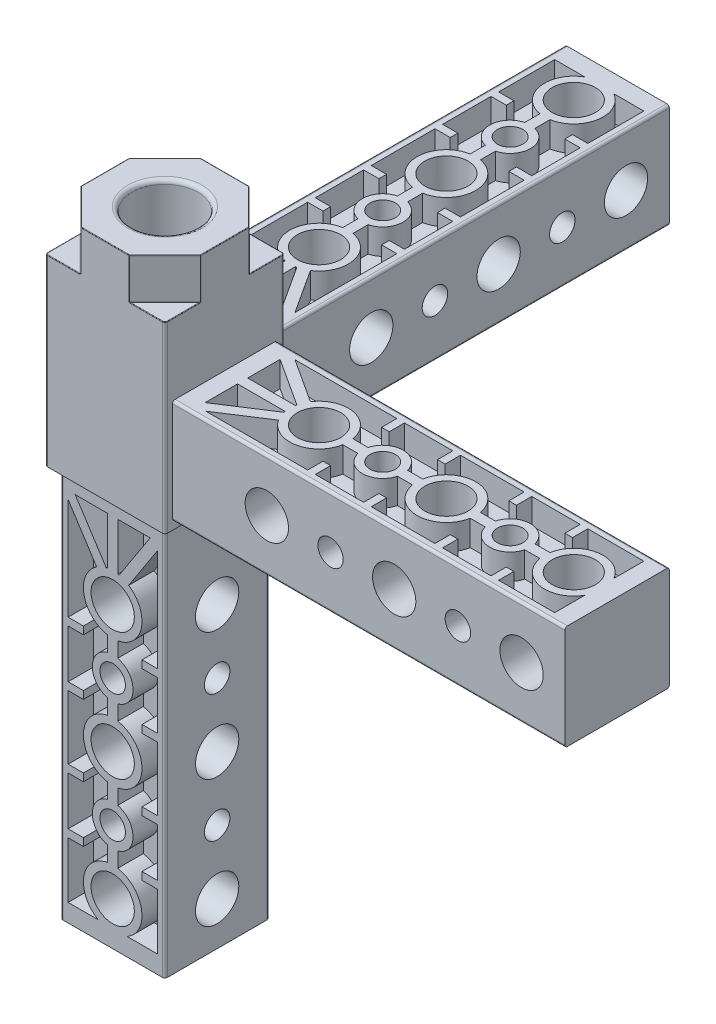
SolidWorks part; units mm, degrees
ref_plane "前视基准面" through (0, 0, 0) normal (0, 0, 1) x (1, 0, 0)
ref_plane "上视基准面" through (0, 0, 0) normal (0, 1, 0) x (1, 0, 0)
ref_plane "右视基准面" through (0, 0, 0) normal (1, 0, 0) x (0, 0, -1)
sketch "草图1" plane through (0, 0, 0) normal (0, 1, 0) x (1, 0, 0)
  line L1 (-11.25, -11.75) -> (11.25, -11.75)
  line L2 (-11.75, -11.25) -> (-11.75, 11.25)
  line L3 (-11.25, 11.75) -> (11.25, 11.75)
  line L4 (11.75, -11.25) -> (11.75, 11.25)
  line L5 (-11.75, -11.75) -> (11.75, 11.75) construction
  line L6 (-11.75, 11.75) -> (11.75, -11.75) construction
  arc A0 (-11.25, -11.75) -> (-11.75, -11.25) centre (-11.25, -11.25) cw
  arc A1 (-11.75, 11.25) -> (-11.25, 11.75) centre (-11.25, 11.25) cw
  arc A2 (11.25, 11.75) -> (11.75, 11.25) centre (11.25, 11.25) cw
  arc A3 (11.25, -11.75) -> (11.75, -11.25) centre (11.25, -11.25) ccw
  point P0 (0, 0)
  dimension "D3" = 0.5
  dimension "D1" = 23.5
  dimension "D2" = 23.5
extrude "拉伸1" add sketch "草图1" along normal blind 44
sketch "草图2" plane through (0, 44, 0) normal (0, 1, 0) x (1, 0, 0)
  line L0 (0, 0) -> (50000, 0) construction
  line L1 (0, 0) -> (0, 50000) construction
  line L2 (-11.25, -11.75) -> (11.25, -11.75) construction
  line L3 (11.75, -11.25) -> (11.75, 11.25) construction
  line L4 (-11.75, 11.25) -> (-11.75, -11.25) construction
  line L5 (11.25, 11.75) -> (-11.25, 11.75) construction
  line L6 (-11.25, -11.75) -> (-4.75, -11.75)
  line L7 (11.75, -11.25) -> (11.75, -4.75)
  line L8 (-11.75, 11.25) -> (-11.75, 4.75)
  line L9 (11.25, 11.75) -> (4.75, 11.75)
  line L10 (-4.75, 11.75) -> (-11.75, 4.75)
  line L11 (4.75, 11.75) -> (11.75, 4.75)
  line L12 (4.75, -11.75) -> (11.75, -4.75)
  line L13 (-4.75, -11.75) -> (-11.75, -4.75)
  line L14 (4.75, -11.75) -> (11.25, -11.75)
  line L15 (-11.75, -4.75) -> (-11.75, -11.25)
  line L16 (11.75, 4.75) -> (11.75, 11.25)
  line L17 (-4.75, 11.75) -> (-11.25, 11.75)
  arc A0 (-11.75, -11.25) -> (-11.25, -11.75) centre (-11.25, -11.25) ccw construction
  arc A1 (11.25, -11.75) -> (11.75, -11.25) centre (11.25, -11.25) ccw construction
  arc A2 (11.75, 11.25) -> (11.25, 11.75) centre (11.25, 11.25) ccw construction
  arc A3 (-11.25, 11.75) -> (-11.75, 11.25) centre (-11.25, 11.25) ccw construction
  arc A4 (-11.75, -11.25) -> (-11.25, -11.75) centre (-11.25, -11.25) ccw
  arc A5 (11.25, -11.75) -> (11.75, -11.25) centre (11.25, -11.25) ccw
  arc A6 (11.75, 11.25) -> (11.25, 11.75) centre (11.25, 11.25) ccw
  arc A7 (-11.25, 11.75) -> (-11.75, 11.25) centre (-11.25, 11.25) ccw
  dimension "D1" = 45
  dimension "D2" = 7
extrude "拉伸2" cut sketch "草图2" against normal blind 8
sketch "草图3" plane through (0, 44, 0) normal (0, 1, 0) x (1, 0, 0)
  circle A0 centre (0, 0) radius 6.5
  dimension "D1" = 13
extrude "拉伸3" cut sketch "草图3" against normal blind 25
fillet "圆角1" radius 0.8 1 edges at (0, 44, 6.5)
fillet "圆角2" radius 0.1 32 edges at (11.75, 40, -4.75) (11.75, 36, -8) (11.6036, 36, 11.6036) (-11.6036, 36, 11.6036) (11.6036, 36, -11.6036) (11.75, 36, 8) (8, 36, 11.75) (-8, 36, 11.75) (-11.75, 36, 8) (8, 36, -11.75) (11.75, 40, 4.75) (8.25, 36, 8.25) (4.75, 40, 11.75) (8.25, 44, 8.25) (-4.75, 40, 11.75) (-8.25, 36, 8.25) (-11.75, 40, 4.75) (-8.25, 44, 8.25) (-11.75, 40, -4.75) (-4.75, 40, -11.75) (-8.25, 44, -8.25) (-8, 36, -11.75) (-8.25, 36, -8.25) (-11.75, 36, -8) (-11.6036, 36, -11.6036) (0, 44, 11.75) (-11.75, 44, 0) (8.25, 36, -8.25) (4.75, 40, -11.75) (0, 44, -11.75) (8.25, 44, -8.25) (11.75, 44, 0)
sketch "草图4" plane through (0, 0, 0) normal (0, -1, 0) x (1, 0, 0)
  line L1 (-9.75, -10.25) -> (9.75, -10.25)
  line L2 (-10.25, -9.75) -> (-10.25, 9.75)
  line L3 (-9.75, 10.25) -> (9.75, 10.25)
  line L4 (10.25, -9.75) -> (10.25, 9.75)
  line L5 (-10.25, -10.25) -> (10.25, 10.25) construction
  line L6 (-10.25, 10.25) -> (10.25, -10.25) construction
  arc A0 (-10.25, 9.75) -> (-9.75, 10.25) centre (-9.75, 9.75) cw
  arc A1 (9.75, 10.25) -> (10.25, 9.75) centre (9.75, 9.75) cw
  arc A2 (9.75, -10.25) -> (10.25, -9.75) centre (9.75, -9.75) ccw
  arc A3 (-9.75, -10.25) -> (-10.25, -9.75) centre (-9.75, -9.75) cw
  point P0 (0, 0)
  dimension "D3" = 0.5
  dimension "D1" = 20.5
  dimension "D2" = 20.5
extrude "拉伸4" add sketch "草图4" along normal blind 77
sketch "草图5" plane through (11.75, 0, 0) normal (1, 0, 0) x (0, 0, -1)
  line L0 (0, 0) -> (0, 43.9) construction
  line L1 (4.7086, 43.9) -> (-4.7086, 43.9) construction
  line L2 (9.75, 0) -> (-9.75, 0) construction
  line L3 (-9.75, 1.5) -> (9.75, 1.5)
  line L4 (-10.25, 2) -> (-10.25, 21.5)
  line L5 (-9.75, 22) -> (9.75, 22)
  line L6 (10.25, 2) -> (10.25, 21.5)
  line L7 (-10.25, 1.5) -> (10.25, 22) construction
  line L8 (-10.25, 22) -> (10.25, 1.5) construction
  arc A0 (-10.25, 21.5) -> (-9.75, 22) centre (-9.75, 21.5) cw
  arc A1 (9.75, 22) -> (10.25, 21.5) centre (9.75, 21.5) cw
  arc A2 (-9.75, 1.5) -> (-10.25, 2) centre (-9.75, 2) cw
  arc A3 (9.75, 1.5) -> (10.25, 2) centre (9.75, 2) ccw
  point P5 (0, 11.75)
  dimension "D4" = 0.5
  dimension "D1" = 1.5
  dimension "D2" = 20.5
  dimension "D3" = 20.5
extrude "拉伸5" add sketch "草图5" along normal blind 77
sketch "草图6" plane through (0, 0, -11.75) normal (0, 0, -1) x (-1, 0, 0)
  line L0 (0, 43.9) -> (0, 0) construction
  line L1 (4.7086, 43.9) -> (-4.7086, 43.9) construction
  line L2 (9.75, 0) -> (-9.75, 0) construction
  line L3 (-9.75, 1.5) -> (9.75, 1.5)
  line L4 (-10.25, 2) -> (-10.25, 21.5)
  line L5 (-9.75, 22) -> (9.75, 22)
  line L6 (10.25, 2) -> (10.25, 21.5)
  line L7 (-10.25, 1.5) -> (10.25, 22) construction
  line L8 (-10.25, 22) -> (10.25, 1.5) construction
  arc A0 (-10.25, 21.5) -> (-9.75, 22) centre (-9.75, 21.5) cw
  arc A1 (-9.75, 1.5) -> (-10.25, 2) centre (-9.75, 2) cw
  arc A2 (9.75, 1.5) -> (10.25, 2) centre (9.75, 2) ccw
  arc A3 (9.75, 22) -> (10.25, 21.5) centre (9.75, 21.5) cw
  point P5 (0, 11.75)
  dimension "D4" = 0.5
  dimension "D1" = 20.5
  dimension "D2" = 20.5
  dimension "D3" = 1.5
extrude "拉伸6" add sketch "草图6" along normal blind 77
sketch "草图14"
sketch_block_instance "块2-1"
sketch_block "块2" parameters "D1"=8.5, "D2"=5
extrude "拉伸13" cut sketch "草图14" against normal through all
sketch "草图15" plane through (0, 22, 0) normal (0, 1, 0) x (-1, 0, 0)
  line L0 (-11.75, 0) -> (-98.6653, 0) construction
  line L1 (-11.75, -9.75) -> (-11.75, 9.75) construction
  dimension "D1" = 18.5
sketch_block_instance "块2-3"
extrude "拉伸14" cut sketch "草图15" against normal through all
sketch "草图16" plane through (10.25, 0, 0) normal (1, 0, 0) x (0, 0, -1)
  line L0 (30.25, 11.75) -> (98.0099, 11.75) construction
  line L1 (11.75, 21.5) -> (11.75, 2) construction
  dimension "D1" = 18.5
sketch_block_instance "块2-6"
extrude "拉伸15" cut sketch "草图16" against normal through all
sketch "草图17" plane through (0, 22, 0) normal (0, 1, 0) x (1, 0, 0)
  line L0 (0, 20.841) -> (0, 94.8507) construction
  line L1 (-9.75, 11.75) -> (9.75, 11.75) construction
  dimension "D1" = 18.5
sketch_block_instance "块2-8"
extrude "拉伸16" cut sketch "草图17" against normal through all
sketch "草图18" plane through (10.25, 0, 0) normal (1, 0, 0) x (0, 0, -1)
  line L0 (0, -18.5) -> (0, -81.3782) construction
  line L1 (9.75, 0) -> (-9.75, 0) construction
  dimension "D1" = 18.5
sketch_block_instance "块2-10"
extrude "拉伸17" cut sketch "草图18" against normal through all
sketch "草图19" plane through (0, 0, 10.25) normal (0, 0, 1) x (1, 0, 0)
  line L0 (0, 0) -> (0, -82.054) construction
  line L1 (9.75, 0) -> (-9.75, 0) construction
  dimension "D1" = 18.5
sketch_block_instance "块2-12"
extrude "拉伸18" cut sketch "草图19" against normal through all
sketch "草图21" plane through (0, 1.5, 0) normal (0, -1, 0) x (1, 0, 0)
sketch_block_instance "块1-1"
sketch_block "块3" parameters "D8"=11.5, "D9"=8, "D20"=5.75, "D21"=4, "D22"=5.75, "D1"=2, "D2"=33, "D3"=2, "D4"=12.5, "D5"=12.5, "D6"=12.5, "D7"=12.5, "D10"=2, "D11"=3, "D12"=1.5, "D13"=9.4789, "D14"=12.5, "D15"=9.5, "D16"=11, "D17"=1.5, "D18"=1.5, "D19"=1.5
extrude "拉伸19" cut sketch "草图21" against normal blind 5
sketch "草图22" plane through (0, 22, 0) normal (0, 1, 0) x (1, 0, 0)
sketch_block_instance "块3-3"
extrude "拉伸20" cut sketch "草图22" against normal blind 5
sketch "草图23" plane through (0, 0, -10.25) normal (0, 0, -1) x (-1, 0, 0)
sketch_block_instance "块3-5"
extrude "拉伸21" cut sketch "草图23" against normal blind 5
sketch "草图24" plane through (0, 0, 10.25) normal (0, 0, 1) x (1, 0, 0)
sketch_block_instance "块3-7"
extrude "拉伸22" cut sketch "草图24" against normal blind 5
sketch "草图25" plane through (0, 1.5, 0) normal (0, -1, 0) x (1, 0, 0)
sketch_block_instance "块3-9"
extrude "拉伸23" cut sketch "草图25" against normal blind 5
sketch "草图26" plane through (0, 22, 0) normal (0, 1, 0) x (1, 0, 0)
sketch_block_instance "块3-11"
extrude "拉伸24" cut sketch "草图26" against normal blind 5
